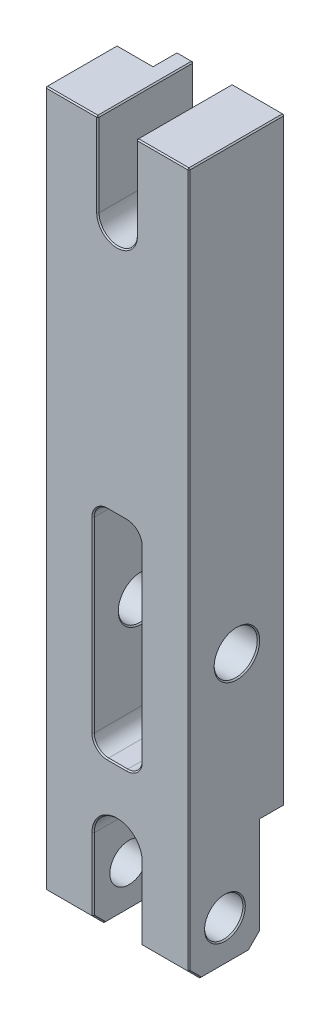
SolidWorks part; units mm, degrees
ref_plane "Plan de face" through (0, 0, 0) normal (0, 0, 1) x (1, 0, 0)
ref_plane "Plan de dessus" through (0, 0, 0) normal (0, 1, 0) x (1, 0, 0)
ref_plane "Plan de droite" through (0, 0, 0) normal (1, 0, 0) x (0, 0, -1)
sketch "Esquisse1" plane through (0, 0, 0) normal (0, 0, 1) x (1, 0, 0)
  line L0 (8, 185) -> (30, 185)
  line L1 (-30, 185) -> (-8, 185)
  line L2 (-30, 185) -> (-30, -110)
  line L3 (-30, -110) -> (-10, -110)
  line L4 (30, 185) -> (30, -110)
  line L5 (-4, 45) -> (4, 45)
  line L6 (-10, 39) -> (-10, -39)
  line L7 (-4, -45) -> (4, -45)
  line L8 (10, 39) -> (10, -39)
  line L9 (10, -110) -> (30, -110)
  line L10 (-8, 185) -> (-8, 150)
  line L12 (8, 185) -> (8, 150)
  line L13 (-10, -75) -> (-10, -110)
  line L15 (10, -75) -> (10, -110)
  arc A0 (-10, -39) -> (-4, -45) centre (-4, -39) ccw
  arc A1 (4, -45) -> (10, -39) centre (4, -39) ccw
  arc A2 (4, 45) -> (10, 39) centre (4, 39) cw
  arc A3 (-4, 45) -> (-10, 39) centre (-4, 39) ccw
  arc A4 (-8, 150) -> (8, 150) centre (0, 150) ccw
  arc A5 (10, -75) -> (-10, -75) centre (0, -75) ccw
  point P15 (10, 45)
  point P18 (-10, 45)
  dimension "D9" = 6
  dimension "D1" = 60
  dimension "D2" = 20
  dimension "D3" = 10
  dimension "D4" = 30
  dimension "D5" = 110
  dimension "D6" = 185
  dimension "D7" = 45
  dimension "D8" = 45
  dimension "D10" = 16
  dimension "D11" = 20
  dimension "D12" = 75
  dimension "D13" = 35
extrude "Volume" add sketch "Esquisse1" along normal blind 40
sketch "Esquisse2" plane through (-30, 0, 0) normal (-1, 0, 0) x (0, 0, 1)
  line L1 (40, 185) -> (40, -110) construction
  circle A0 centre (25, -93) radius 8
  dimension "D2" = 16
  dimension "D1" = 15
  dimension "D3" = 93
extrude "Alésage Ø16" cut sketch "Esquisse2" against normal through all
sketch "Esquisse4" plane through (0, 0, 0) normal (0, 0, -1) x (-1, 0, 0)
  line L0 (-40, -65) -> (15, -65)
  line L1 (15, -65) -> (40, -21.6987)
  line L2 (40, -21.6987) -> (40, 21.6987)
  line L3 (55, -120) -> (-40, -120)
  line L4 (-40, -120) -> (-40, -65)
  line L5 (30, 185) -> (30, -110) construction
  line L8 (-30, -110) -> (-30, 185) construction
  line L9 (30, -110) -> (10, -110) construction
  line L10 (40, 21.6987) -> (18.3494, 59.1987)
  line L11 (15, 71.6987) -> (15, 200)
  line L12 (15, 200) -> (55, 200)
  line L13 (55, 200) -> (55, -120)
  line L15 (30, 185) -> (30, -110) construction
  line L16 (8, 185) -> (30, 185) construction
  line L17 (-10, -110) -> (-30, -110) construction
  arc A0 (18.3494, 59.1987) -> (15, 71.6987) centre (40, 71.6987) cw
  point P23 (15, 65)
  point P24 (-20, -110)
  dimension "D11" = 25
  dimension "D1" = 65
  dimension "D2" = 120
  dimension "D3" = 15
  dimension "D4" = 30
  dimension "D5" = 10
  dimension "D6" = 10
  dimension "D7" = 65
  dimension "D8" = 10
  dimension "D9" = 25
  dimension "D10" = 15
  dimension "D12" = 45
extrude "Dégagement fraise à rainurer" cut sketch "Esquisse4" against normal blind 10
chamfer "Chanfreins 5mm" distance 5 angle 45 4 edges at (-20, -110, 10) (20, -110, 10) (20, -110, 40) (-20, -110, 40)
sketch "Esquisse5" plane through (-30, 0, 0) normal (-1, 0, 0) x (0, 0, 1)
  circle A0 centre (20, 0) radius 9
  dimension "D1" = 18
  dimension "D2" = 20
extrude "Enlèv. mat.-Extru.4" cut sketch "Esquisse5" against normal through all
chamfer "Chanfrein1" distance 0.5 angle 45 69 edges at (-10, 0, 0) (-8.2426, 43.2426, 0) (0, 45, 0) (8.2426, 43.2426, 0) (10, 0, 0) (8.2426, -43.2426, 0) (0, -45, 0) (-8.2426, -43.2426, 0) (19, 185, 0) (8, 167.5, 0) (0, 142, 0) (-8, 167.5, 0) (-11.5, 185, 0) (-15, 128.3494, 0) (-15.8519, 65.2283, 0) (-24.1747, 49.109, 0) (-30, 0, 0) (-22.5, -52.0096, 0) (7.5, -65, 0) (30, 60, 0) (-10, 9, 20) (10, -9, 20) (-10, 0, 40) (-8.2426, -43.2426, 40) (0, -45, 40) (8.2426, -43.2426, 40) (10, 0, 40) (8.2426, 43.2426, 40) (0, 45, 40) (-8.2426, 43.2426, 40) (30, -9, 20) (-10, -90, 40) (0, -65, 40) (10, -90, 40) (-30, -72.0096, 10) (-30, -107.5, 12.5) (-30, -110, 25) (-30, -107.5, 37.5) (30, 40, 40) (19, 185, 40) (8, 167.5, 40) (0, 142, 40) (-8, 167.5, 40) (-19, 185, 40) (-30, 40, 40) (-30, -9, 20) (10, -85, 25) (30, -101, 25) (-10, -107.5, 37.5) (-10, -110, 25) (-10, -107.5, 12.5) (-10, -90, 10) (-7.0711, -67.9289, 10) (7.0711, -67.9289, 10) (10, -90, 10) (10, -107.5, 12.5) (10, -110, 25) (10, -107.5, 37.5) (-15, 185, 5) (-22.5, 185, 10) (-30, 185, 25) (-8, 185, 20) (8, 185, 20) (30, 185, 20) (30, -65, 5) (30, -85, 10) (30, -107.5, 12.5) (30, -110, 25) (30, -107.5, 37.5)
